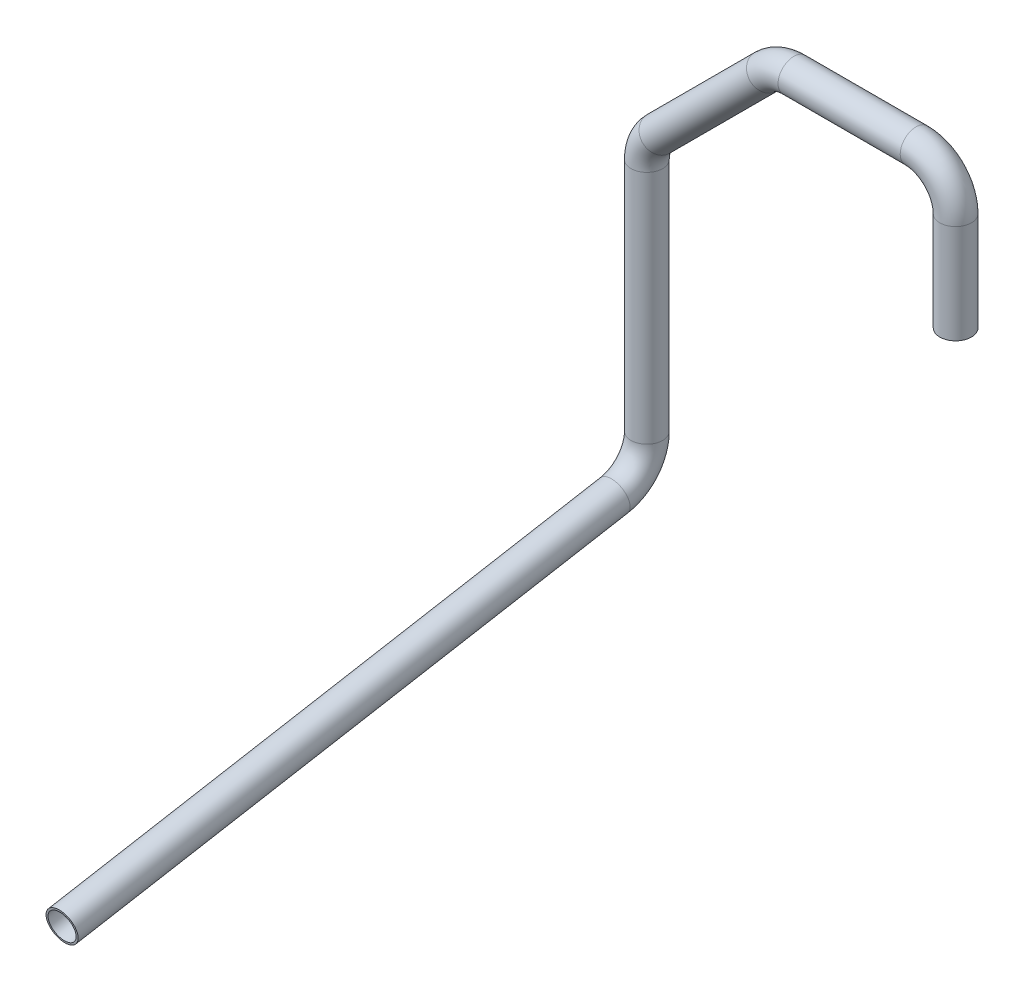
SolidWorks part; units mm, degrees
ref_plane "Front Plane" through (0, 0, 0) normal (0, 0, 1) x (1, 0, 0)
ref_plane "Top Plane" through (0, 0, 0) normal (0, 1, 0) x (1, 0, 0)
ref_plane "Right Plane" through (0, 0, 0) normal (1, 0, 0) x (0, 0, -1)
sketch "Sketch6" plane through (0, 0, 0) normal (0, 0, 1) x (1, 0, 0)
  line L0 (0, 0) -> (0, 25)
  line L1 (-10, 35) -> (-40.8579, 35)
  line L2 (-47.9289, 32.0711) -> (-75.0711, 4.9289)
  line L3 (-78, -2.1421) -> (-78, -70)
  arc A0 (0, 25) -> (-10, 35) centre (-10, 25) ccw
  arc A1 (-75.0711, 4.9289) -> (-78, -2.1421) centre (-68, -2.1421) ccw
  arc A2 (-40.8579, 35) -> (-47.9289, 32.0711) centre (-40.8579, 25) ccw
  point P6 (0, 35)
  point P13 (-45, 35)
  dimension "D3" = 10
  dimension "D7" = 10
  dimension "D1" = 35
  dimension "D2" = 45
  dimension "D4" = 78
  dimension "D5" = 45
  dimension "D6" = 105
sketch "Sketch7" plane through (0, 0, 0) normal (0, 1, 0) x (1, 0, 0)
  circle A0 centre (0, 0) radius 4
  circle A1 centre (0, 0) radius 3.5
  dimension "D1" = 8
  dimension "D2" = 0.5
sketch3d "3DSketch2"
  line L0 (-78, -2.1421, 0) -> (-78, -70, 0) construction
  line L1 (-47.9289, 32.0711, 0) -> (-75.0711, 4.9289, 0) construction
  line L2 (-10, 35, 0) -> (-40.8579, 35, 0) construction
  line L3 (0, 0, 0) -> (0, 25, 0) construction
  line L4 (-78, -2.1421, 0) -> (-78, -61.609, 0)
  line L5 (-47.9289, 32.0711, 0) -> (-75.0711, 4.9289, 0)
  line L6 (-10, 35, 0) -> (-40.8579, 35, 0)
  line L7 (0, 0, 0) -> (0, 25, 0)
  line L8 (-78, -71.4571, -8.2635) -> (-78, -96.0472, -147.7212)
  line L9 (-78, -70, 0) -> (-78, -70, -20.9252) construction
  line L10 (0, 0, 0) -> (0, -70, 0) construction
  line L11 (0, -70, 0) -> (-78, -70, 0) construction
  arc A0 (-75.0711, 4.9289, 0) -> (-78, -2.1421, 0) centre (-68, -2.1421, 0) ccw construction
  arc A1 (-40.8579, 35, 0) -> (-47.9289, 32.0711, 0) centre (-40.8579, 25, 0) ccw construction
  arc A2 (0, 25, 0) -> (-10, 35, 0) centre (-10, 25, 0) ccw construction
  arc A3 (-75.0711, 4.9289, 0) -> (-78, -2.1421, 0) centre (-68, -2.1421, 0) ccw
  arc A4 (-40.8579, 35, 0) -> (-47.9289, 32.0711, 0) centre (-40.8579, 25, 0) ccw
  arc A5 (0, 25, 0) -> (-10, 35, 0) centre (-10, 25, 0) ccw
  arc A6 (-78, -61.609, 0) -> (-78, -71.4571, -8.2635) centre (-78, -61.609, -10) ccw
  point P5 (-68, -2.1421, 10)
  point P9 (-40.8579, 25, 10)
  point P13 (-10, 25, 10)
  point P14 (-68, -2.1421, 10)
  point P15 (-40.8579, 25, 10)
  point P16 (-10, 25, 10)
  point P24 (-78, -70, 0)
  point P26 (-68, -61.609, -10)
  dimension "D3" = 10
  dimension "D1" = 10
  dimension "D2" = 90
  dimension "D4" = 150
sweep "Sweep4" add profiles "Sketch7" path "3DSketch2"
move or copy body "Body-Move/Copy1" bodies to move or copy 102
